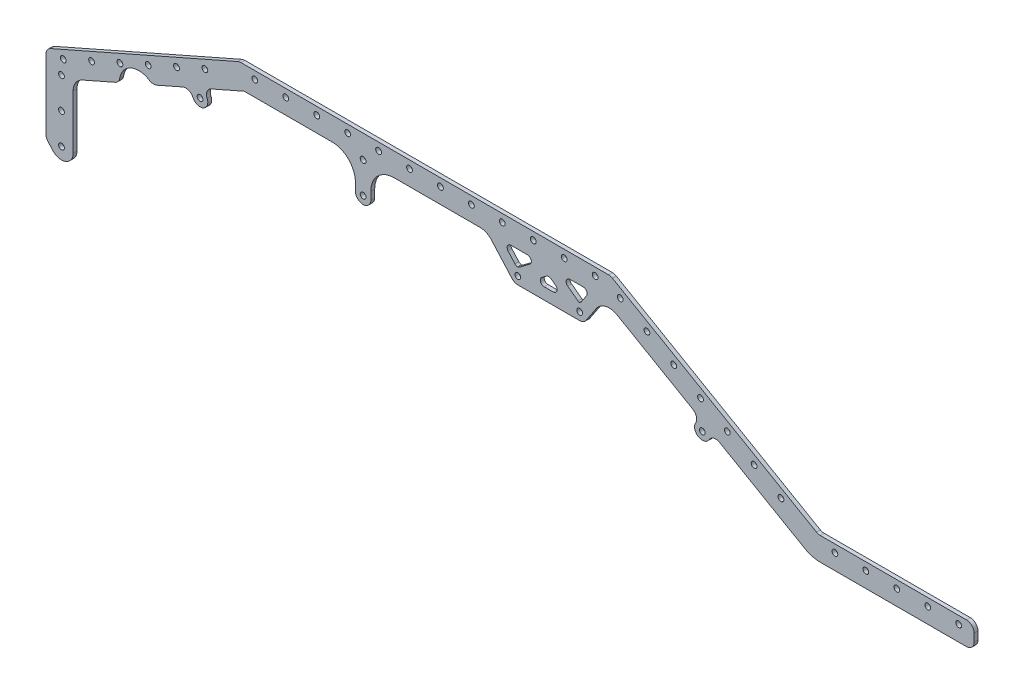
SolidWorks part; units mm, degrees
ref_plane "Front Plane" through (0, 0, 0) normal (0, 0, 1) x (1, 0, 0)
ref_plane "Top Plane" through (0, 0, 0) normal (0, 1, 0) x (1, 0, 0)
ref_plane "Right Plane" through (0, 0, 0) normal (1, 0, 0) x (0, 0, -1)
sketch "Sketch1" plane through (0, 0, 0) normal (0, 0, 1) x (1, 0, 0)
  line L0 (-151.6714, -12.7) -> (-31.75, -12.7) construction
  line L1 (-322.3765, 84.8743) -> (-154.8464, -11.8493) construction
  line L2 (-627.3148, 85.725) -> (-325.5515, 85.725) construction
  line L3 (-783.6074, 17.5437) -> (-629.8722, 85.1873) construction
  line L4 (-151.6714, -12.7) -> (-31.75, -12.7)
  line L5 (-322.3765, 84.8743) -> (-154.8464, -11.8493)
  line L6 (-627.3148, 85.725) -> (-325.5515, 85.725)
  line L7 (-783.6074, 17.5437) -> (-629.8722, 85.1873)
  line L8 (-787.4, -45.3765) -> (-787.4, 11.7315) construction
  line L9 (-787.4, -45.3765) -> (-787.4, 11.7315)
  line L10 (-765.116, -47.625) -> (-765.116, 4.8674)
  line L11 (-785.783, -49.6098) -> (-763.617, -74.3922) construction
  line L12 (-785.783, -49.6098) -> (-763.617, -74.3922)
  line L13 (-768.35, 3.4445) -> (-624.6443, 66.675) construction
  line L14 (-25.4, -19.05) -> (-25.4, -89.8994) construction
  line L15 (-765.116, 4.8674) -> (-669.2951, 47.0287)
  line L16 (-624.6443, 66.675) -> (-533.4, 66.675)
  line L17 (-328.9544, 66.675) -> (-250.8861, 21.6022)
  line L18 (-151.6714, -31.75) -> (-31.75, -31.75)
  line L19 (-768.35, -40.5255) -> (-768.35, 3.4445) construction
  line L20 (-768.35, -40.5255) -> (-749.418, -61.6922) construction
  line L21 (-25.4, -19.05) -> (-25.4, -89.8994)
  line L22 (-31.75, -31.75) -> (-25.4, -31.75)
  line L23 (-533.4, 41.275) -> (-533.4, 66.675)
  line L24 (-520.7, 41.275) -> (-520.7, 66.675)
  line L25 (-425.45, 66.675) -> (-404.799, 43.4096)
  line L26 (-400.05, 41.275) -> (-349.25, 41.275)
  line L27 (-328.9544, 66.675) -> (-343.9626, 44.1085)
  line L28 (-425.45, 66.675) -> (-401.299, 39.4665) construction
  line L29 (-412.714, 66.675) -> (-382.5875, 66.675)
  line L30 (-328.9544, 66.675) -> (-347.587, 38.6588) construction
  line L31 (-374.65, 60.7219) -> (-361.4208, 50.8)
  line L32 (-399.5474, 53.9551) -> (-382.5875, 66.675)
  line L33 (-366.7125, 66.675) -> (-349.7526, 53.9551)
  line L34 (-412.714, 66.675) -> (-401.3261, 53.8455)
  line L35 (-340.3936, 66.675) -> (-348.8484, 53.9623)
  line L36 (-336.8856, 71.9497) -> (-355.5181, 43.9335) construction
  line L37 (-624.6443, 66.675) -> (-328.9544, 66.675) construction
  line L38 (-250.8861, 21.6022) -> (-254.0611, 16.103)
  line L39 (-239.8876, 15.2522) -> (-243.0626, 9.753)
  line L40 (-366.7125, 66.675) -> (-340.3936, 66.675)
  line L41 (-239.8876, 15.2522) -> (-164.3714, -28.347)
  line L42 (-328.9544, 66.675) -> (-164.3714, -28.347) construction
  line L43 (-657.6706, 52.1434) -> (-655.1132, 46.3312)
  line L44 (-520.7, 66.675) -> (-425.45, 66.675)
  line L45 (-387.8792, 50.8) -> (-361.4208, 50.8)
  line L46 (-387.8792, 50.8) -> (-374.65, 60.7219)
  line L47 (-669.2951, 47.0287) -> (-666.7377, 41.2164)
  line L49 (-418.3265, 72.998) -> (-394.1754, 45.7895) construction
  line L50 (-657.6706, 52.1434) -> (-624.6443, 66.675)
  arc A0 (-154.8464, -11.8493) -> (-151.6714, -12.7) centre (-151.6714, -6.35) ccw construction
  arc A1 (-322.3765, 84.8743) -> (-325.5515, 85.725) centre (-325.5515, 79.375) ccw construction
  arc A2 (-627.3148, 85.725) -> (-629.8722, 85.1873) centre (-627.3148, 79.375) ccw construction
  arc A3 (-154.8464, -11.8493) -> (-151.6714, -12.7) centre (-151.6714, -6.35) ccw
  arc A4 (-322.3765, 84.8743) -> (-325.5515, 85.725) centre (-325.5515, 79.375) ccw
  arc A5 (-627.3148, 85.725) -> (-629.8722, 85.1873) centre (-627.3148, 79.375) ccw
  arc A6 (-783.6074, 17.5437) -> (-787.4, 11.7315) centre (-781.05, 11.7315) ccw construction
  circle A7 centre (-660.9254, 43.7738) radius 2.3813
  circle A8 centre (-660.9254, 43.7738) radius 2.3812
  circle A9 centre (-527.05, 66.675) radius 2.3813
  circle A10 centre (-527.05, 66.675) radius 2.3812
  circle A11 centre (-527.05, 41.275) radius 2.3813
  circle A12 centre (-527.05, 41.275) radius 2.3812
  circle A13 centre (-400.05, 47.625) radius 2.3813
  circle A14 centre (-400.05, 47.625) radius 2.3813
  circle A15 centre (-349.25, 47.625) radius 2.3813
  circle A16 centre (-349.25, 47.625) radius 2.3813
  circle A17 centre (-248.5618, 12.928) radius 2.3813
  circle A18 centre (-248.5618, 12.928) radius 2.3813
  arc A19 (-348.8484, 53.9623) -> (-349.7526, 53.9551) centre (-349.25, 47.625) ccw
  arc A20 (-783.6074, 17.5437) -> (-787.4, 11.7315) centre (-781.05, 11.7315) ccw
  circle A21 centre (-774.7, -47.625) radius 2.3813 construction
  circle A22 centre (-774.7, -22.225) radius 2.3813 construction
  circle A23 centre (-774.7, 3.175) radius 2.3813 construction
  circle A24 centre (-774.7, -47.625) radius 2.3812
  circle A25 centre (-774.7, -22.225) radius 2.3812
  circle A26 centre (-774.7, 3.175) radius 2.3812
  arc A27 (-781.8435, -54.0143) -> (-765.116, -47.625) centre (-774.7, -47.625) ccw
  arc A28 (-787.4, -45.3765) -> (-785.783, -49.6098) centre (-781.05, -45.3765) ccw construction
  arc A29 (-787.4, -45.3765) -> (-785.783, -49.6098) centre (-781.05, -45.3765) ccw
  arc A30 (-768.35, -40.5255) -> (-768.35, -40.5255) centre (-768.35, -40.5255) ccw
  arc A31 (-768.35, 3.4445) -> (-768.35, 3.4445) centre (-768.35, 3.4445) ccw
  arc A32 (-624.6443, 66.675) -> (-624.6443, 66.675) centre (-624.6443, 66.675) ccw
  arc A33 (-328.9544, 66.675) -> (-328.9544, 66.675) centre (-328.9544, 66.675) ccw
  arc A34 (-164.3714, -28.347) -> (-151.6714, -31.75) centre (-151.6714, -6.35) ccw
  arc A35 (-666.7377, 41.2164) -> (-655.1132, 46.3312) centre (-660.9254, 43.7738) ccw
  arc A36 (-533.4, 41.275) -> (-520.7, 41.275) centre (-527.05, 41.275) ccw
  arc A37 (-404.799, 43.4096) -> (-400.05, 41.275) centre (-400.05, 47.625) ccw
  arc A38 (-349.25, 41.275) -> (-343.9626, 44.1085) centre (-349.25, 47.625) ccw
  arc A39 (-254.0611, 16.103) -> (-243.0626, 9.753) centre (-248.5618, 12.928) ccw
  arc A40 (-25.4, -19.05) -> (-31.75, -12.7) centre (-31.75, -19.05) ccw construction
  arc A41 (-25.4, -19.05) -> (-31.75, -12.7) centre (-31.75, -19.05) ccw
  arc A42 (-399.5474, 53.9551) -> (-401.3261, 53.8455) centre (-400.05, 47.625) ccw
  dimension "D7" = 19.05
  dimension "D8" = 12.7
  dimension "D9" = 25.4
  dimension "D1" = 0
  dimension "D2" = 0
  dimension "D3" = 0
  dimension "D4" = 0
  dimension "D5" = 0
  dimension "D6" = 0
  dimension "D12" = 9.525
  dimension "D13" = 9.525
extrude "Boss-Extrude1" add sketch "Sketch1" along normal blind 3.175 contours L21 A41 L4 A3 L5 A4 L6 A5 L7 A20 L9 A29 L12 A27 L10 L15 L47 A35 L43 L50 L16 L23 A36 L24 L44 L25 A37 L26 A38 L27 L17 L38 A39 L39 L41 A34 L18 L22 L35 A19 L33 L40 L45 L46 L31 A8 A10
fillet "Fillet1" radius 19.05 2 edges at (-533.4, 66.675, 1.5875) (-520.7, 66.675, 1.5875)
fillet "Fillet2" radius 6.35 5 edges at (-250.8861, 21.6022, 1.5875) (-239.8876, 15.2522, 1.5875) (-657.6706, 52.1434, 1.5875) (-669.2951, 47.0287, 1.5875) (-25.4, -31.75, 1.5875)
fillet "Fillet3" radius 12.7 3 edges at (-765.116, 4.8674, 1.5875) (-328.9544, 66.675, 1.5875) (-425.45, 66.675, 1.5875)
fillet "Fillet4" radius 3.175 11 edges at (-401.3261, 53.8455, 1.5875) (-399.5474, 53.9551, 1.5875) (-382.5875, 66.675, 1.5875) (-412.714, 66.675, 1.5875) (-387.8792, 50.8, 1.5875) (-374.65, 60.7219, 1.5875) (-361.4208, 50.8, 1.5875) (-349.7526, 53.9551, 1.5875) (-348.8484, 53.9623, 1.5875) (-340.3936, 66.675, 1.5875) (-366.7125, 66.675, 1.5875)
sketch "Sketch2" plane through (0, 0, 3.175) normal (0, 0, 1) x (1, 0, 0)
  circle A1 centre (-703.4711, 45.8662) radius 2.3813
  circle A2 centre (-703.4711, 45.8662) radius 2.3812
  circle A3 centre (-726.7201, 35.6367) radius 2.3813
  circle A4 centre (-726.7201, 35.6367) radius 2.3812
  circle A5 centre (-749.9691, 25.4071) radius 2.3813
  circle A6 centre (-749.9691, 25.4071) radius 2.3812
  circle A7 centre (-773.2181, 15.1775) radius 2.3813
  circle A8 centre (-773.2181, 15.1775) radius 2.3812
  circle A9 centre (-294.0294, 61.1757) radius 2.3813
  circle A10 centre (-294.0294, 61.1757) radius 2.3813
  circle A11 centre (-316.0265, 73.8757) radius 2.3813
  circle A12 centre (-316.0265, 73.8757) radius 2.3813
  circle A13 centre (-336.55, 79.375) radius 2.3812
  circle A14 centre (-336.55, 79.375) radius 2.3812
  circle A15 centre (-361.95, 79.375) radius 2.3812
  circle A16 centre (-361.95, 79.375) radius 2.3812
  circle A17 centre (-387.35, 79.375) radius 2.3812
  circle A18 centre (-387.35, 79.375) radius 2.3812
  circle A19 centre (-412.75, 79.375) radius 2.3812
  circle A20 centre (-412.75, 79.375) radius 2.3812
  circle A21 centre (-438.15, 79.375) radius 2.3812
  circle A22 centre (-438.15, 79.375) radius 2.3812
  circle A23 centre (-463.55, 79.375) radius 2.3812
  circle A24 centre (-463.55, 79.375) radius 2.3812
  circle A25 centre (-488.95, 79.375) radius 2.3812
  circle A26 centre (-488.95, 79.375) radius 2.3812
  circle A27 centre (-514.35, 79.375) radius 2.3813
  circle A28 centre (-514.35, 79.375) radius 2.3812
  circle A29 centre (-539.75, 79.375) radius 2.3812
  circle A30 centre (-539.75, 79.375) radius 2.3812
  circle A31 centre (-565.15, 79.375) radius 2.3813
  circle A32 centre (-565.15, 79.375) radius 2.3812
  circle A33 centre (-590.55, 79.375) radius 2.3813
  circle A34 centre (-590.55, 79.375) radius 2.3812
  circle A35 centre (-615.95, 79.375) radius 2.3813
  circle A36 centre (-615.95, 79.375) radius 2.3812
  circle A37 centre (-656.9731, 66.3253) radius 2.3813
  circle A38 centre (-656.9731, 66.3253) radius 2.3812
  circle A39 centre (-680.2221, 56.0958) radius 2.3813
  circle A40 centre (-680.2221, 56.0958) radius 2.3812
  circle A41 centre (-38.1, -19.05) radius 2.3813
  circle A42 centre (-38.1, -19.05) radius 2.3812
  circle A43 centre (-63.5, -19.05) radius 2.3813
  circle A44 centre (-63.5, -19.05) radius 2.3812
  circle A45 centre (-88.9, -19.05) radius 2.3812
  circle A46 centre (-88.9, -19.05) radius 2.3812
  circle A47 centre (-114.3, -19.05) radius 2.3813
  circle A48 centre (-114.3, -19.05) radius 2.3813
  circle A49 centre (-139.7, -19.05) radius 2.3813
  circle A50 centre (-139.7, -19.05) radius 2.3813
  circle A51 centre (-184.0442, -2.3243) radius 2.3813
  circle A52 centre (-184.0442, -2.3243) radius 2.3813
  circle A53 centre (-206.0413, 10.3757) radius 2.3813
  circle A54 centre (-206.0413, 10.3757) radius 2.3813
  circle A55 centre (-228.0383, 23.0757) radius 2.3813
  circle A56 centre (-228.0383, 23.0757) radius 2.3813
  circle A57 centre (-250.0353, 35.7757) radius 2.3813
  circle A58 centre (-250.0353, 35.7757) radius 2.3813
  circle A59 centre (-272.0324, 48.4757) radius 2.3813
  circle A60 centre (-272.0324, 48.4757) radius 2.3813
  dimension "D1" = 0
  dimension "D2" = 0
  dimension "D3" = 0
  dimension "D4" = 0
  dimension "D5" = 0
  dimension "D6" = 0
  dimension "D7" = 0
  dimension "D8" = 0
  dimension "D9" = 0
  dimension "D10" = 0
  dimension "D11" = 0
  dimension "D12" = 0
  dimension "D13" = 0
  dimension "D14" = 0
  dimension "D15" = 0
  dimension "D16" = 0
  dimension "D17" = 0
  dimension "D18" = 0
  dimension "D19" = 0
  dimension "D20" = 0
  dimension "D21" = 0
  dimension "D22" = 0
  dimension "D23" = 0
  dimension "D24" = 0
  dimension "D25" = 0
  dimension "D26" = 0
  dimension "D27" = 0
  dimension "D28" = 0
  dimension "D29" = 0
  dimension "D30" = 0
extrude "Cut-Extrude1" cut sketch "Sketch2" against normal blind 3.175
sketch "Sketch3" plane through (0, 0, 3.175) normal (0, 0, 1) x (1, 0, 0)
  circle A0 centre (-711.2, 22.225) radius 15.875
  dimension "D1" = 31.75
extrude "Cut-Extrude2" cut sketch "Sketch3" against normal blind 3.175
fillet "Fillet5" radius 6.35 2 edges at (-700.0299, 33.5053, 1.5875) (-727.0631, 21.6107, 1.5875)
